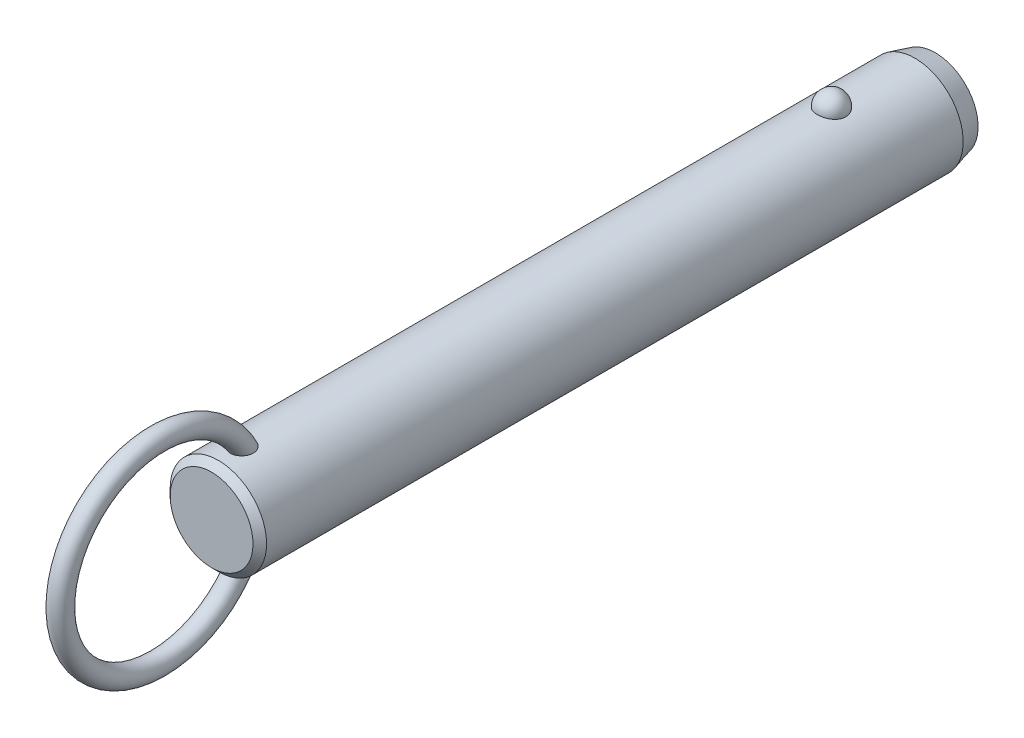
SolidWorks part; units mm, degrees
ref_plane "Front Plane" through (0, 0, 0) normal (0, 0, 1) x (1, 0, 0)
ref_plane "Top Plane" through (0, 0, 0) normal (0, 1, 0) x (1, 0, 0)
ref_plane "Right Plane" through (0, 0, 0) normal (1, 0, 0) x (0, 0, -1)
sketch "Sketch2" plane through (0, 0, 0) normal (0, 0, 1) x (1, 0, 0)
  circle A0 centre (0, 0) radius 7.1
  point P3 (0, 7.1)
  dimension "D1" = 14.2
extrude "Boss-Extrude1" add sketch "Sketch2" along normal blind 81.3
sketch "Sketch3" plane through (0, 0, 0) normal (0, 0, -1) x (-1, 0, 0)
  circle A0 centre (0, 0) radius 7.1
  dimension "D1" = 14.2
extrude "Boss-Extrude2" add sketch "Sketch3" along normal blind 17.4
chamfer "Chamfer1" distance 3 angle 15 1 edges at (-7.1, 0, -17.4)
sketch "Sketch12" plane through (0, 0, 0) normal (1, 0, 0) x (0, 0, -1)
  line L0 (-81.3, 7.1) -> (-81.3, -7.1) construction
  point P0 (-81.3, 0)
sketch "Sketch13" plane through (0, 0, 0) normal (1, 0, 0) x (0, 0, -1)
  circle A0 centre (-97.15, 0) radius 15.85
  point P2 (-81.3, 0)
  dimension "D1" = 31.7
sketch "Sketch14" plane through (0, 0, 0) normal (0, 1, 0) x (1, 0, 0)
  circle A0 centre (0, -82.8) radius 1.5
  point P2 (0, -81.3)
  dimension "D1" = 3
sweep "Sweep1" add profiles "Sketch14" path "Sketch13"
sketch "Sketch15" plane through (0, 0, 81.3) normal (0, 0, 1) x (1, 0, 0)
  circle A0 centre (0, 0) radius 7.1
  dimension "D1" = 14.2
extrude "Boss-Extrude3" add sketch "Sketch15" along normal blind 7.92
chamfer "Chamfer2" distance 1 angle 45 1 edges at (7.1, 0, 89.22)
sketch "Sketch18" plane through (0, 0, 0) normal (1, 0, 0) x (0, 0, -1)
  line L0 (14.4, 7.1) -> (-82.9792, 7.1) construction
  line L1 (2.1, 9.2) -> (2.1, 5)
  line L2 (-82.9792, -7.1) -> (14.4, -7.1) construction
  arc A0 (2.1, 9.2) -> (2.1, 5) centre (2.1, 7.1) ccw
  point P4 (0, 7.1)
  dimension "D1" = 16.3
revolve "Revolve1" add sketch "Sketch18" angle 360 about L1
